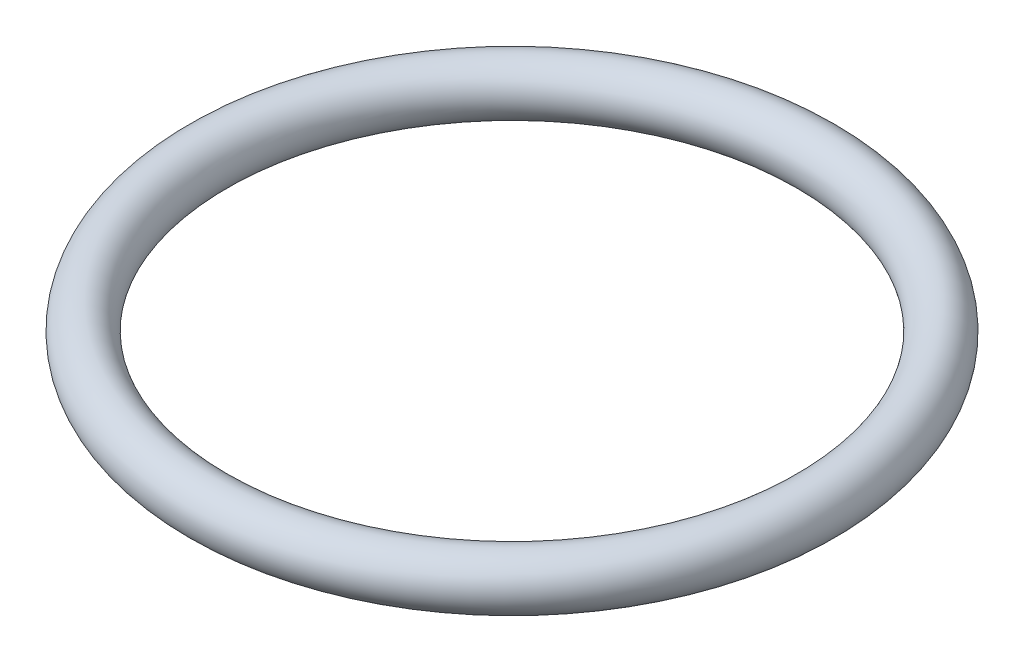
SolidWorks part; units mm, degrees
ref_plane "Front Plane" through (0, 0, 0) normal (0, 0, 1) x (1, 0, 0)
ref_plane "Top Plane" through (0, 0, 0) normal (0, 1, 0) x (1, 0, 0)
ref_plane "Right Plane" through (0, 0, 0) normal (1, 0, 0) x (0, 0, -1)
sketch "Sketch1" plane through (0, 0, 0) normal (0, 0, 1) x (1, 0, 0)
  line L0 (0, 0) -> (0, 21.0682) construction
  line L1 (0, 0) -> (10.2743, 0) construction
  circle A0 centre (10.2743, 0) radius 0.889
  point P5 (9.3853, 0)
  dimension "D2" = 1.778
  dimension "D1" = 18.7706
revolve "Revolve1" add sketch "Sketch1" angle 360 about L0
